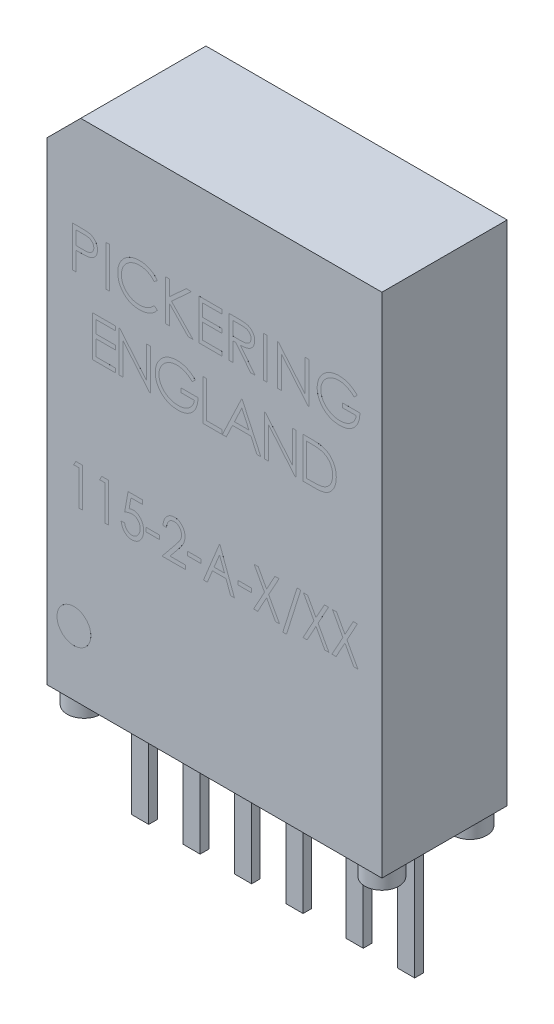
SolidWorks part; units mm, degrees
ref_plane "Front Plane" through (0, 0, 0) normal (0, 0, 1) x (1, 0, 0)
ref_plane "Top Plane" through (0, 0, 0) normal (0, 1, 0) x (1, 0, 0)
ref_plane "Right Plane" through (0, 0, 0) normal (1, 0, 0) x (0, 0, -1)
sketch "Sketch1" plane through (0, 0, 0) normal (0, 1, 0) x (1, 0, 0)
  line L1 (4.95, -1.85) -> (-4.95, -1.85)
  line L2 (4.95, -1.85) -> (4.95, 1.85)
  line L3 (4.95, 1.85) -> (-4.95, 1.85)
  line L4 (-4.95, -1.85) -> (-4.95, 1.85)
  line L5 (4.95, -1.85) -> (-4.95, 1.85) construction
  line L6 (4.95, 1.85) -> (-4.95, -1.85) construction
  point P0 (0, 0)
  dimension "D1" = 3.7
  dimension "D2" = 9.9
extrude "Main body" add sketch "Sketch1" along normal blind 14.992
sketch "Sketch2" plane through (0, 0, 1.85) normal (0, 0, 1) x (1, 0, 0)
  line L0 (-3.95, 14.992) -> (-4.95, 13.992)
  line L1 (-4.95, 14.992) -> (4.95, 14.992) construction
  line L2 (-4.95, 14.992) -> (-4.95, 0) construction
  line L3 (-4.95, 13.992) -> (-4.95, 14.992)
  line L4 (-4.95, 14.992) -> (-3.95, 14.992)
  dimension "D1" = 45
  dimension "D2" = 8.9
extrude "Box style cut" cut sketch "Sketch2" against normal through all
sketch "Sketch3" plane through (0, 0, 0) normal (0, -1, 0) x (1, 0, 0)
  line L0 (-4.95, 1.85) -> (4.95, 1.85) construction
  line L1 (-4.95, -1.85) -> (-4.95, 1.85) construction
  line L2 (4.95, -1.85) -> (-4.95, -1.85) construction
  line L3 (4.95, 1.85) -> (4.95, -1.85) construction
  circle A0 centre (-4.4, 1.3) radius 0.5
  circle A1 centre (-4.4, -1.3) radius 0.5
  circle A2 centre (4.4, -1.3) radius 0.5
  circle A3 centre (4.4, 1.3) radius 0.5
  dimension "D1" = 1
  dimension "D4" = 1
  dimension "D7" = 1
  dimension "D9" = 1
  dimension "D2" = 0.55
  dimension "D3" = 0.55
  dimension "D5" = 0.55
  dimension "D6" = 0.55
  dimension "D8" = 0.55
  dimension "D10" = 0.55
  dimension "D11" = 0.55
  dimension "D12" = 0.55
extrude "Feet" add sketch "Sketch3" along normal blind 0.508
sketch "Sketch4" plane through (0, 0, 0) normal (0, -1, 0) x (1, 0, 0)
  line L1 (-3.676, -0.14) -> (-4.184, -0.14)
  line L2 (-3.676, -0.14) -> (-3.676, 0.114)
  line L3 (-3.676, 0.114) -> (-4.184, 0.114)
  line L4 (-4.184, -0.14) -> (-4.184, 0.114)
  line L5 (-3.676, -0.14) -> (-4.184, 0.114) construction
  line L6 (-3.676, 0.114) -> (-4.184, -0.14) construction
  line L7 (-2.156, -0.14) -> (-2.664, -0.14)
  line L8 (-2.156, -0.14) -> (-2.156, 0.114)
  line L9 (-2.156, 0.114) -> (-2.664, 0.114)
  line L10 (-2.664, -0.14) -> (-2.664, 0.114)
  line L11 (-2.156, -0.14) -> (-2.664, 0.114) construction
  line L12 (-2.156, 0.114) -> (-2.664, -0.14) construction
  line L13 (-0.636, -0.14) -> (-1.144, -0.14)
  line L14 (-0.636, -0.14) -> (-0.636, 0.114)
  line L15 (-0.636, 0.114) -> (-1.144, 0.114)
  line L16 (-1.144, -0.14) -> (-1.144, 0.114)
  line L17 (-0.636, -0.14) -> (-1.144, 0.114) construction
  line L18 (-0.636, 0.114) -> (-1.144, -0.14) construction
  line L19 (0.884, -0.14) -> (0.376, -0.14)
  line L20 (0.884, -0.14) -> (0.884, 0.114)
  line L21 (0.884, 0.114) -> (0.376, 0.114)
  line L22 (0.376, -0.14) -> (0.376, 0.114)
  line L23 (0.884, -0.14) -> (0.376, 0.114) construction
  line L24 (0.884, 0.114) -> (0.376, -0.14) construction
  line L27 (2.662, -0.14) -> (2.154, -0.14)
  line L28 (2.662, -0.14) -> (2.662, 0.114)
  line L29 (2.662, 0.114) -> (2.154, 0.114)
  line L30 (2.154, -0.14) -> (2.154, 0.114)
  line L31 (2.662, -0.14) -> (2.154, 0.114) construction
  line L32 (2.662, 0.114) -> (2.154, -0.14) construction
  line L33 (4.182, -0.14) -> (3.674, -0.14)
  line L34 (4.182, -0.14) -> (4.182, 0.114)
  line L35 (4.182, 0.114) -> (3.674, 0.114)
  line L36 (3.674, -0.14) -> (3.674, 0.114)
  line L37 (4.182, -0.14) -> (3.674, 0.114) construction
  line L38 (4.182, 0.114) -> (3.674, -0.14) construction
  point P0 (-3.93, -0.013)
  point P5 (-2.41, -0.013)
  point P10 (-0.89, -0.013)
  point P15 (0.63, -0.013)
  point P22 (2.408, -0.013)
  point P27 (3.928, -0.013)
  dimension "D1" = 0.508
  dimension "D2" = 0.254
  dimension "D3" = 0.508
  dimension "D4" = 0.254
  dimension "D5" = 0.508
  dimension "D6" = 0.254
  dimension "D7" = 0.508
  dimension "D8" = 0.254
  dimension "D9" = 1.52
  dimension "D10" = 1.52
  dimension "D11" = 1.52
  dimension "D12" = 3.93
  dimension "D13" = 0.508
  dimension "D14" = 0.508
  dimension "D15" = 1.778
  dimension "D16" = 1.52
extrude "Pins" add sketch "Sketch4" along normal blind 3.808
sketch "Sketch5"
  dimension "D5" = 1
  dimension "D1" = 4
  dimension "D2" = 2
  dimension "D3" = 4
  dimension "D6" = 1.9
  dimension "D7" = 0.8
extrude "Lettering" add sketch "Sketch5" along normal blind 0.0001
